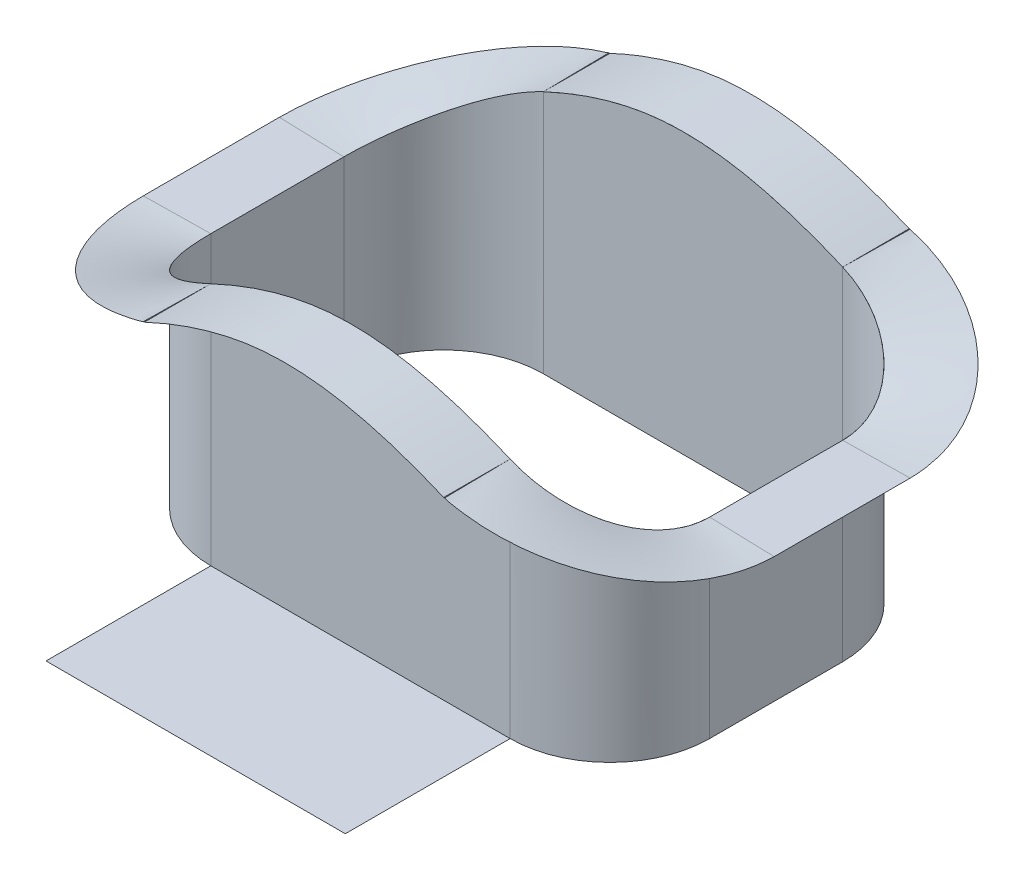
SolidWorks part; units mm, degrees
ref_plane "Front" through (0, 0, 0) normal (0, 0, 1) x (1, 0, 0)
ref_plane "Top" through (0, 0, 0) normal (0, 1, 0) x (1, 0, 0)
ref_plane "Right" through (0, 0, 0) normal (1, 0, 0) x (0, 0, -1)
sketch "Sketch2" plane through (0, 0, 0) normal (0, 1, 0) x (1, 0, 0)
  line L0 (75, -50) -> (-75, 50) construction
  line L1 (-75, 50) -> (75, 50)
  line L2 (-75, 50) -> (-75, -50)
  line L3 (-75, -50) -> (75, -50)
  line L4 (75, 50) -> (75, -50)
  dimension "D1" = 150
  dimension "D2" = 100
surface "Surface-Extrude1" sketch "Sketch2" parameters "D1"=139.5565
fillet "Fillet1" radius 30 4 edges at (75, 69.7782, -50) (-75, 69.7782, -50) (-75, 69.7782, 50) (75, 69.7782, 50)
sketch "Sketch3" plane through (0, 0, 50) normal (0, 0, 1) x (1, 0, 0)
  spline_without_curve S0
surface "Surface-Trim2"
sketch "Sketch6" plane through (0, 0, 50) normal (0, 0, 1) x (1, 0, 0)
  line L0 (-45, 0) -> (45, 0) construction
  line L1 (-45, 0) -> (45, 0)
surface "Surface-Extrude2" sketch "Sketch6" parameters "D1"=49.5565
surface "Surface-Radiate1" parameters "D1"=20
